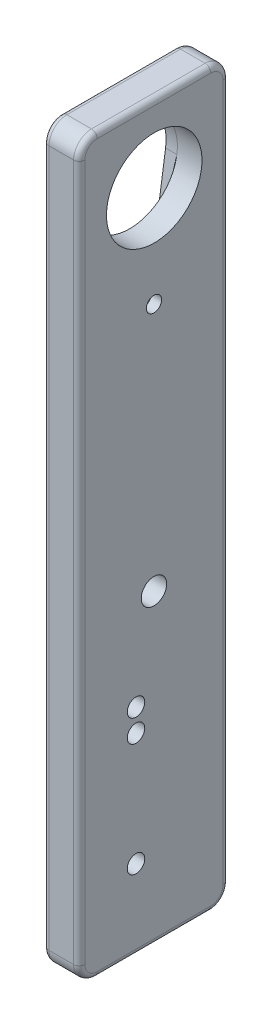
SolidWorks part; units mm, degrees
ref_plane "Front Plane" through (0, 0, 0) normal (0, 0, 1) x (1, 0, 0)
ref_plane "Top Plane" through (0, 0, 0) normal (0, 1, 0) x (1, 0, 0)
ref_plane "Right Plane" through (0, 0, 0) normal (1, 0, 0) x (0, 0, -1)
imported_body "Forearm of 3 DOF Arm-1-solid1"
sketch "Sketch2" plane through (-45.951, 0, 0) normal (-1, 0, 0) x (0, 0, 1)
  line L3 (-3.6715, 25.7097) -> (6.9185, 25.7097)
  line L5 (-6.7857, 46.8542) -> (-3.6715, 25.7097)
  line L6 (10.0328, 46.8542) -> (6.9185, 25.7097)
  arc A1 (10.0328, 46.8542) -> (-6.7857, 46.8542) centre (1.6235, 48.0927) ccw
extrude "Cut-Extrude1" cut sketch "Sketch2" against normal blind 2
sketch "Sketch3" plane through (-45.951, 0, 0) normal (-1, 0, 0) x (0, 0, 1)
  circle A0 centre (1.6235, 30.3127) radius 4
extrude "Cut-Extrude2" cut sketch "Sketch3" against normal through all
sketch "Sketch5" plane through (-43.951, 0, 0) normal (-1, 0, 0) x (0, 0, 1)
  circle A0 centre (1.5732, 48.0961) radius 8.4496
extrude "Cut-Extrude3" cut sketch "Sketch5" against normal through all
fillet "Fillet1" radius 1 16 edges at (-39.601, 60.7477, -10.6715) (-39.601, 61.6776, 1.6235) (-39.601, 60.7477, 13.9186) (-39.601, -66.9925, 13.9186) (-39.601, -67.9224, 1.6235) (-39.601, -66.9925, -10.6715) (-45.951, 60.7477, -10.6715) (-45.951, 61.6776, 1.6235) (-45.951, 60.7477, 13.9186) (-45.951, -3.1224, 14.8485) (-45.951, -66.9925, 13.9186) (-45.951, -67.9224, 1.6235) (-45.951, -66.9925, -10.6715) (-39.601, -3.1224, 14.8485) (-39.601, -3.1224, -11.6015) (-45.951, -3.1224, -11.6015)
sketch "Sketch7" plane through (-43.951, 0, 0) normal (-1, 0, 0) x (0, 0, 1)
  circle A0 centre (1.622, 30.3157) radius 4.0034
  circle A1 centre (1.622, 30.3157) radius 1.35
  dimension "D1" = 2.7
extrude "Boss-Extrude1" add sketch "Sketch7" against normal up to surface (4.35 mm away)
sketch "Sketch8" plane through (-43.951, 0, 0) normal (-1, 0, 0) x (0, 0, 1)
  circle A0 centre (1.622, 30.3157) radius 1.35
  circle A1 centre (1.622, 30.3157) radius 3.9
  dimension "D1" = 7.8
extrude "Cut-Extrude4" cut sketch "Sketch8" against normal blind 2.54
